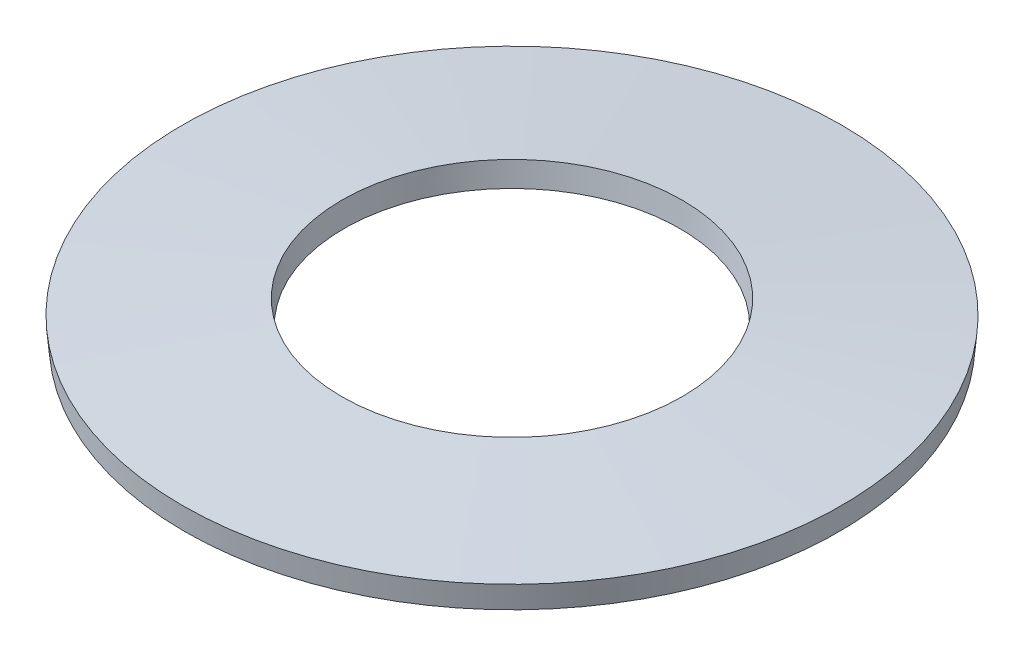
SolidWorks part; units mm, degrees
ref_plane "Front" through (0, 0, 0) normal (0, 0, 1) x (1, 0, 0)
ref_plane "Top" through (0, 0, 0) normal (0, 1, 0) x (1, 0, 0)
ref_plane "Right" through (0, 0, 0) normal (1, 0, 0) x (0, 0, -1)
sketch "Sketch1" plane through (0, 0, 0) normal (0, 0, 1) x (1, 0, 0)
  line L0 (0, 0) -> (0, -6.0586) construction
  line L1 (3.2802, 0) -> (6.35, -0.2813)
  line L2 (3.2802, 0) -> (3.2385, -0.4553)
  line L3 (3.2385, -0.4553) -> (6.3083, -0.7366)
  line L4 (6.35, -0.2813) -> (6.3083, -0.7366)
  dimension "D1" = 0.4572
  dimension "D2" = 6.477
  dimension "D3" = 12.7
  dimension "D4" = 0.7366
revolve "Revolve1" add sketch "Sketch1" angle 360 about L0
